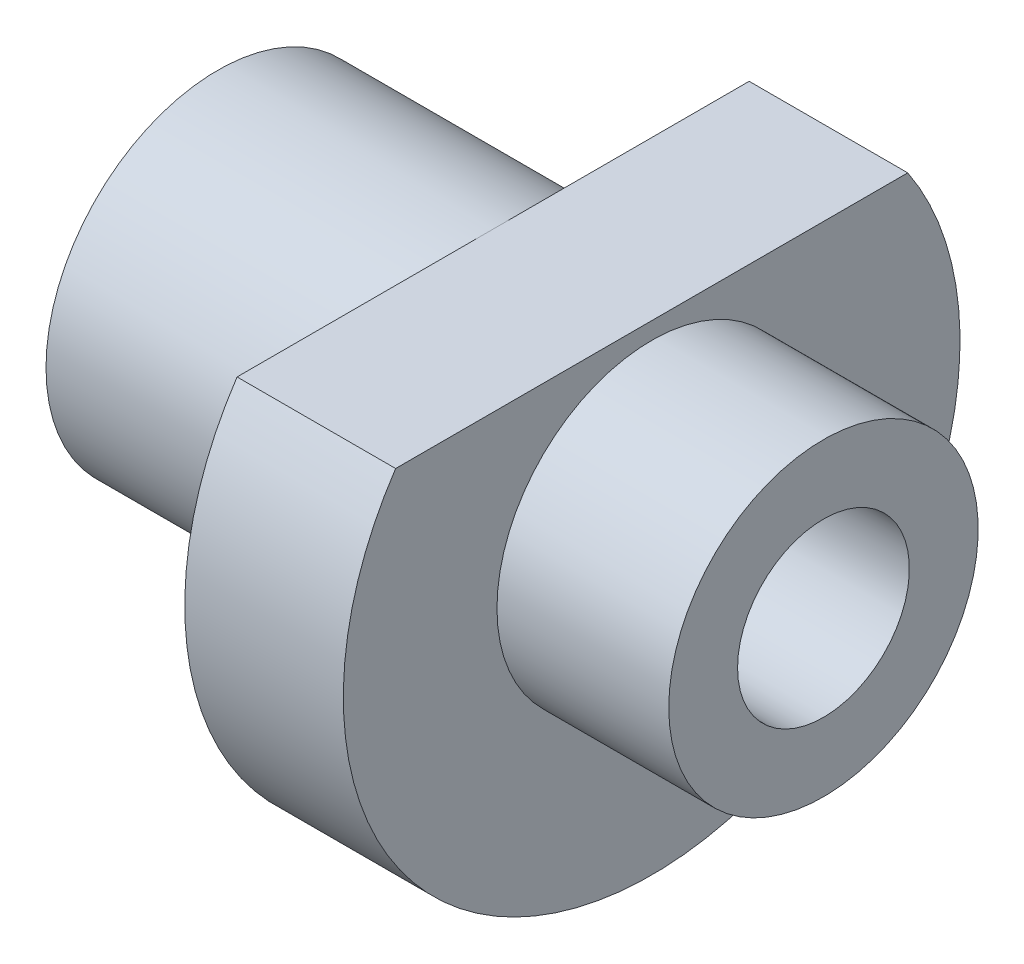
SolidWorks part; units mm, degrees
ref_plane "Plane1" through (0, 0, 0) normal (0, 0, 1) x (1, 0, 0)
ref_plane "Plane2" through (0, 0, 0) normal (0, 1, 0) x (1, 0, 0)
ref_plane "Plane3" through (0, 0, 0) normal (1, 0, 0) x (0, 0, -1)
sketch "Sketch1" plane through (0, 0, 0) normal (0, 0, 1) x (1, 0, 0)
  line L0 (0, 3.9624) -> (0, 7.9248)
  line L1 (0, 7.9248) -> (12.7, 7.9248)
  line L2 (12.7, 7.9248) -> (12.7, 14.224)
  line L3 (12.7, 14.224) -> (20.0152, 14.224)
  line L4 (20.0152, 14.224) -> (20.0152, 7.1374)
  line L5 (20.0152, 7.1374) -> (27.94, 7.1374)
  line L6 (27.94, 7.1374) -> (27.94, 3.9624)
  line L7 (0, 0) -> (27.2486, 0) construction
  line L8 (0, 3.9624) -> (27.94, 3.9624)
  dimension "D1" = 3.9624
  dimension "D2" = 7.1374
  dimension "D3" = 14.224
  dimension "D4" = 7.9248
  dimension "D5" = 27.94
  dimension "D6" = 7.9248
  dimension "D7" = 12.7
  dimension "D8" = 27.94
revolve "Base-Revolve" add sketch "Sketch1" angle 360 about L7
sketch "Sketch2" plane through (20.0152, 0, 0) normal (1, 0, 0) x (0, 0, -1)
  line L0 (-11.8118, 7.9248) -> (11.8118, 7.9248)
  circle A0 centre (0, 0) radius 14.224 construction
  arc A1 (11.8118, 7.9248) -> (-11.8118, 7.9248) centre (0, 0) ccw
  dimension "D1" = 7.9248
extrude "Cut-Extrude1" cut sketch "Sketch2" against normal through all
